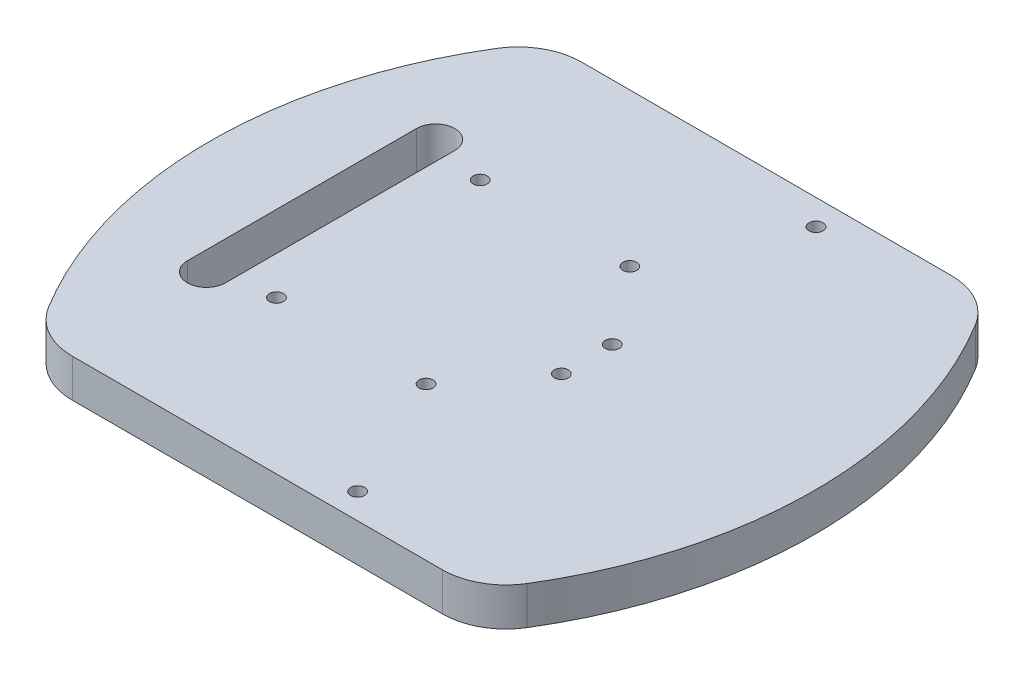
SolidWorks part; units mm, degrees
ref_plane "Plan de face" through (0, 0, 0) normal (0, 0, 1) x (1, 0, 0)
ref_plane "Plan de dessus" through (0, 0, 0) normal (0, 1, 0) x (1, 0, 0)
ref_plane "Plan de droite" through (0, 0, 0) normal (1, 0, 0) x (0, 0, -1)
sketch "Esquisse1" plane through (0, 0, 0) normal (0, 1, 0) x (1, 0, 0)
  line L0 (-111.0793, 0) -> (144.6389, 0) construction
  line L1 (0, -103.2463) -> (0, 92.4278) construction
  line L2 (-35, 40) -> (78.1596, 40) construction
  line L3 (5.6, 47) -> (5.6, 29.4615) construction
  line L4 (6.75, 42.1123) -> (6.75, 8.5) construction
  line L5 (36.9653, 36) -> (2.8283, 36) construction
  line L6 (34.3052, 20) -> (65, 20) construction
  line L7 (29, 54.1791) -> (29, -44.9752) construction
  line L8 (-34.0535, 40) -> (24.0535, 40)
  line L9 (-34.0535, -40) -> (24.0535, -40)
  line L10 (-39.7987, 16) -> (58.2616, 16) construction
  line L11 (-46.2908, 32) -> (36.9653, 32) construction
  line L12 (-38, 44.6634) -> (-38, -34.2446) construction
  line L13 (-9.5, 9.9383) -> (-9.5, -28.5023) construction
  line L14 (-2.5, 9.9383) -> (-2.5, 22.7519) construction
  line L15 (-26, 9.9383) -> (-26, 22.7519) construction
  line L16 (-35, 25.2191) -> (-35, -14.3295) construction
  line L17 (-64.3052, -63) -> (-26, -63) construction
  line L18 (26, -63) -> (34.3052, -63) construction
  line L19 (-26, -63) -> (-26, -47) construction
  line L20 (26, -63) -> (26, -47) construction
  line L21 (-22, -43) -> (22, -43) construction
  line L22 (26, 63) -> (34.3052, 63) construction
  line L23 (26, 63) -> (26, 47) construction
  line L24 (-22, 43) -> (22, 43) construction
  line L25 (-26, 63) -> (-26, 47) construction
  line L26 (-64.3052, 63) -> (-26, 63) construction
  line L27 (-38, 18) -> (-38, -18)
  line L28 (-32, 18) -> (-32, -18)
  line L29 (19, 36.0508) -> (19, -36) construction
  line L30 (22.8, 26.8888) -> (22.8, -60.7912) construction
  line L31 (28.9411, 24.2) -> (-65.8756, 24.2) construction
  line L32 (-65.8756, -24.2) -> (28.9411, -24.2) construction
  arc A0 (34.3052, -63) -> (34.3052, 63) centre (-15, 0) ccw construction
  arc A1 (-42.5846, -35.2174) -> (-34.0535, -40) centre (-34.0535, -30) ccw
  arc A2 (-42.5846, -35.2174) -> (-42.5846, 35.2174) centre (15, 0) cw
  arc A3 (-34.0535, 40) -> (-42.5846, 35.2174) centre (-34.0535, 30) ccw
  circle A4 centre (-2.5, 16) radius 1.1
  circle A5 centre (-26, 16) radius 1.1
  circle A6 centre (-2.5, -16) radius 1.1
  circle A7 centre (-26, -16) radius 1.1
  arc A9 (26, 47) -> (22, 43) centre (22, 47) cw construction
  arc A10 (-64.3052, 63) -> (-64.3052, -63) centre (-15, 0) ccw construction
  arc A11 (-22, 43) -> (-26, 47) centre (-22, 47) cw construction
  arc A12 (22, -43) -> (26, -47) centre (22, -47) cw construction
  arc A13 (-26, -47) -> (-22, -43) centre (-22, -47) cw construction
  circle A14 centre (-35, -8.5) radius 1.1 construction
  circle A15 centre (-29, 4) radius 2.5 construction
  circle A16 centre (-71, -31.5) radius 1.1 construction
  circle A17 centre (-71, 31.5) radius 1.1 construction
  circle A18 centre (-80, 0) radius 1.1 construction
  circle A19 centre (-35, 8.5) radius 1.1 construction
  circle A20 centre (-35, 0) radius 3.25 construction
  circle A21 centre (-29, -4) radius 2.5 construction
  circle A22 centre (-80, 0) radius 9 construction
  circle A23 centre (6.75, 36) radius 1.1
  circle A24 centre (6.75, 4) radius 1.1
  circle A25 centre (6.75, -36) radius 1.1
  circle A26 centre (6.75, -4) radius 1.1
  arc A28 (-32, -18) -> (-38, -18) centre (-35, -18) cw
  arc A29 (-32, 18) -> (-38, 18) centre (-35, 18) ccw
  arc A31 (32.5846, -35.2174) -> (24.0535, -40) centre (24.0535, -30) cw
  arc A33 (32.5846, -35.2174) -> (32.5846, 35.2174) centre (-25, 0) ccw
  arc A35 (24.0535, 40) -> (32.5846, 35.2174) centre (24.0535, 30) cw
  point P31 (0, -40)
  point P37 (0, 40)
  dimension "D8" = 28.5
  dimension "D9" = 38
  dimension "D13" = 3
  dimension "D16" = 48.4
  dimension "D4" = 22.25
  dimension "D7" = 16
  dimension "D1" = 40
  dimension "D2" = 1.15
  dimension "D3" = 20
  dimension "D5" = 57
  dimension "D6" = 32
  dimension "D10" = 7
  dimension "D11" = 23.5
  dimension "D14" = 57.8
  dimension "D15" = 24.2
extrude "Extrusion1" add sketch "Esquisse1" along normal blind 6
